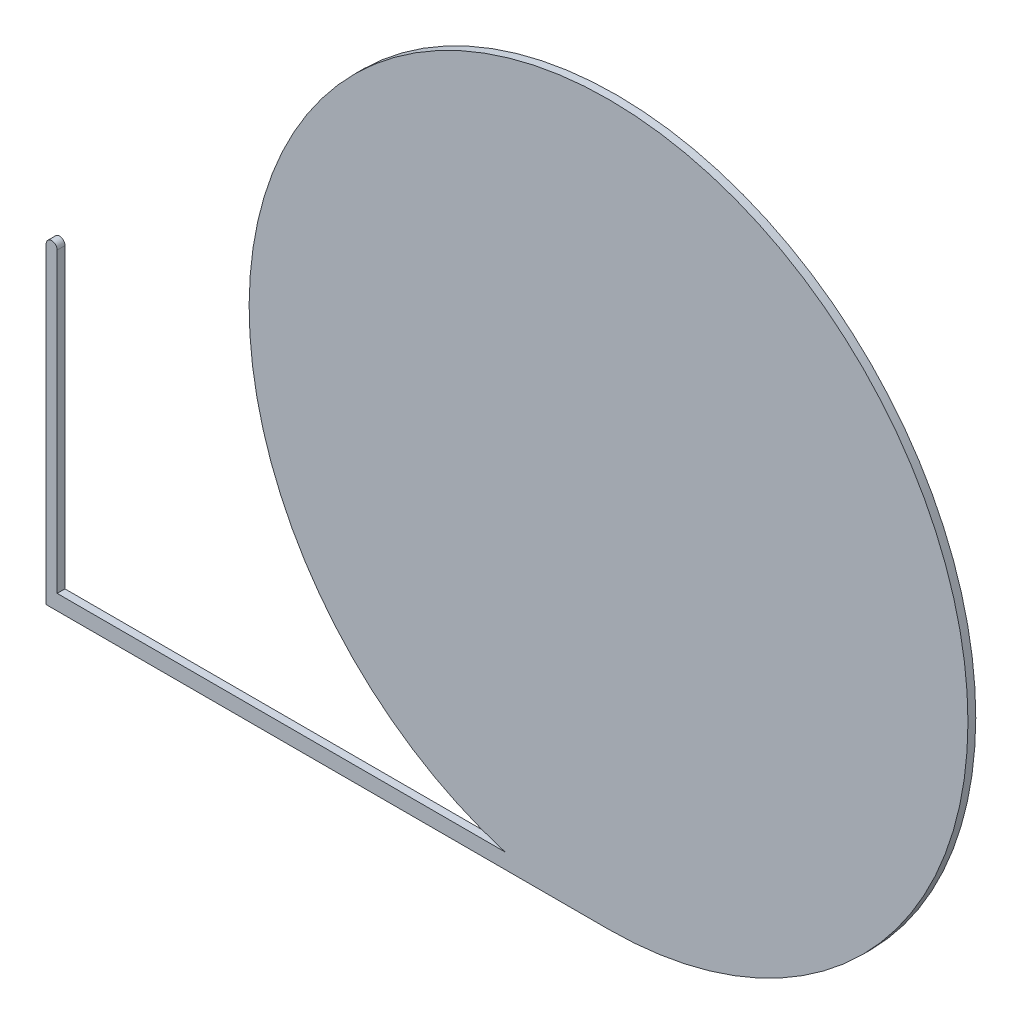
SolidWorks part; units mm, degrees
ref_plane "Face" through (0, 0, 0) normal (0, 0, 1) x (1, 0, 0)
ref_plane "Dessus" through (0, 0, 0) normal (0, 1, 0) x (1, 0, 0)
ref_plane "Droite" through (0, 0, 0) normal (1, 0, 0) x (0, 0, -1)
sketch "Esquisse1" plane through (0, 0, 0) normal (0, 0, 1) x (1, 0, 0)
  line L0 (0, -460) -> (-719.68, -460)
  line L1 (-705.68, -60) -> (-705.68, -440.5132)
  line L2 (-719.68, -60) -> (-719.68, -460)
  line L3 (-132.4693, -440.5132) -> (-705.68, -440.5132)
  arc A0 (0, -460) -> (-132.4693, -440.5132) centre (0, 0) ccw
  arc A1 (-718.915, -56.818) -> (-719.68, -60) centre (-712.68, -60) ccw
  arc A2 (-705.68, -60) -> (-718.915, -56.818) centre (-712.68, -60) ccw
  dimension "D1" = 920
  dimension "D2" = 14
  dimension "D3" = 60
extrude "Extrusion1" add sketch "Esquisse1" along normal blind 10
ref_plane "Plan1" through (0, -60, 0) normal (0, -1, 0) x (1, 0, 0)
ref_plane "Plan2" through (0, 178.72, 0) normal (0, -1, 0) x (1, 0, 0)
